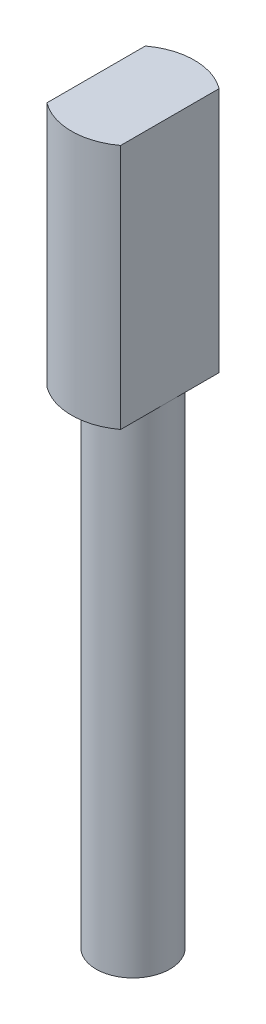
SolidWorks part; units mm, degrees
ref_plane "Front Plane" through (0, 0, 0) normal (0, 0, 1) x (1, 0, 0)
ref_plane "Top Plane" through (0, 0, 0) normal (0, 1, 0) x (1, 0, 0)
ref_plane "Right Plane" through (0, 0, 0) normal (1, 0, 0) x (0, 0, -1)
sketch "Sketch1" plane through (0, 0, 0) normal (0, 1, 0) x (1, 0, 0)
  circle A0 centre (0, 0) radius 3
  dimension "D1" = 6
extrude "Extrude1" add sketch "Sketch1" along normal blind 60
sketch "Sketch2" plane through (0, 0, 0) normal (0, -1, 0) x (1, 0, 0)
  circle A0 centre (0, 0) radius 1.5
  dimension "D1" = 3
extrude "Extrude2" cut sketch "Sketch2" against normal blind 4.5
sketch "Sketch3" plane through (0, 60, 0) normal (0, 1, 0) x (1, 0, 0)
  circle A0 centre (0, 0) radius 5
  dimension "D1" = 10
extrude "Extrude3" add sketch "Sketch3" against normal blind 20
sketch "Sketch4" plane through (0, 60, 0) normal (0, 1, 0) x (1, 0, 0)
  line L0 (0, 5) -> (0, -5) construction
  line L1 (-3, 5) -> (-3, -5)
  line L2 (3, 5) -> (3, -5)
  line L3 (3, 5) -> (5.6797, 5)
  line L4 (5.6797, 5) -> (5.6797, -5)
  line L5 (5.6797, -5) -> (3, -5)
  line L6 (-3, 5) -> (-5.7997, 5)
  line L7 (-5.7997, 5) -> (-5.7997, -5)
  line L8 (-5.7997, -5) -> (-3, -5)
  circle A0 centre (0, 0) radius 5 construction
  dimension "D1" = 3
  dimension "D2" = 3
extrude "Extrude4" cut sketch "Sketch4" against normal blind 20
